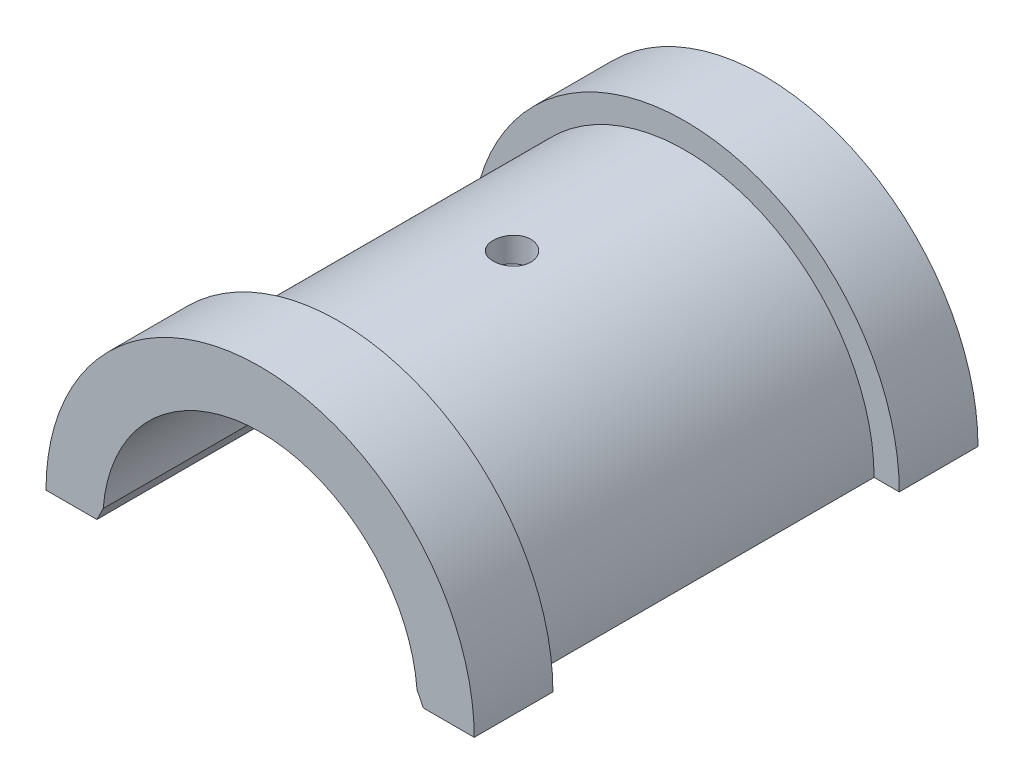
SolidWorks part; units mm, degrees
ref_plane "前视基准面" through (0, 0, 0) normal (0, 0, 1) x (1, 0, 0)
ref_plane "上视基准面" through (0, 0, 0) normal (0, 1, 0) x (1, 0, 0)
ref_plane "右视基准面" through (0, 0, 0) normal (1, 0, 0) x (0, 0, -1)
sketch "草图1" plane through (0, 0, 0) normal (0, 0, 1) x (1, 0, 0)
  line L0 (-30, 70) -> (-25, 70)
  line L1 (25, 70) -> (30, 70)
  line L2 (40, 70) -> (34, 70) construction
  arc A0 (-25, 70) -> (25, 70) centre (0, 70) cw
  arc A2 (-30, 70) -> (30, 70) centre (0, 70) cw
  dimension "D1" = 25
  dimension "D2" = 30
extrude "拉伸1" add sketch "草图1" along normal mid plane 80
sketch "草图3" plane through (0, 0, 40) normal (0, 0, 1) x (1, 0, 0)
  line L0 (-25, 70) -> (-34, 70)
  line L1 (34, 70) -> (25, 70)
  arc A0 (-34, 70) -> (34, 70) centre (0, 70) cw
  arc A1 (25, 70) -> (-25, 70) centre (0, 70) ccw
extrude "拉伸2" add sketch "草图3" against normal up to surface (12.5 mm away)
sketch "草图4" plane through (0, 0, -40) normal (0, 0, -1) x (-1, 0, 0)
  line L4 (34, 70) -> (25, 70)
  line L5 (-25, 70) -> (-34, 70)
  arc A1 (34, 70) -> (-34, 70) centre (0, 70) ccw construction
  arc A2 (34, 70) -> (-34, 70) centre (0, 70) ccw
  arc A3 (25, 70) -> (-25, 70) centre (0, 70) ccw construction
  arc A4 (25, 70) -> (-25, 70) centre (0, 70) ccw
extrude "拉伸3" add sketch "草图4" against normal up to surface (12.5 mm away)
sketch "草图6" plane through (0, 0, 40) normal (0, 0, 1) x (1, 0, 0)
  line L0 (-25.9199, 70) -> (-24.9199, 70)
  line L1 (-34, 70) -> (-25, 70) construction
  line L2 (-24.9199, 70) -> (-24.9199, 72)
  line L3 (-24.9199, 72) -> (-25.9199, 70)
  arc A0 (25, 70) -> (-25, 70) centre (0, 70) ccw construction
  dimension "D1" = 2
  dimension "D2" = 1
extrude "切除-拉伸2" cut sketch "草图6" against normal through all
mirror "镜向1" about plane through (0, 0, 0) normal (1, 0, 0) of "切除-拉伸2"
sketch "草图7" plane through (0, 0, 0) normal (0, 0, 1) x (1, 0, 0)
  line L0 (0, 120.5288) -> (0, 70) construction
  line L1 (0, 96) -> (-3, 96)
  line L2 (-3, 96) -> (-3, 101)
  line L3 (-3, 101) -> (0, 101)
  line L4 (0, 101) -> (0, 96)
  arc A0 (24.9199, 72) -> (-24.9199, 72) centre (0, 70) ccw construction
  dimension "D1" = 3
  dimension "D2" = 26
  dimension "D3" = 5
revolve "切除-旋转1" cut sketch "草图7" angle 360 about L0
